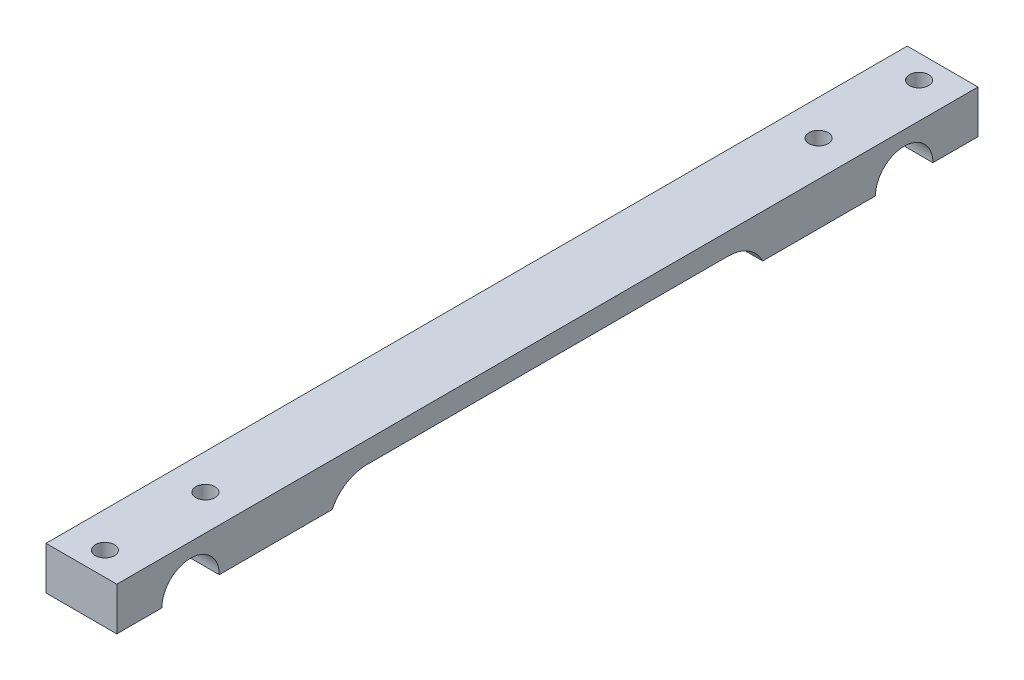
SolidWorks part; units mm, degrees
ref_plane "Front Plane" through (0, 0, 0) normal (0, 0, 1) x (1, 0, 0)
ref_plane "Top Plane" through (0, 0, 0) normal (0, 1, 0) x (1, 0, 0)
ref_plane "Right Plane" through (0, 0, 0) normal (1, 0, 0) x (0, 0, -1)
sketch "Sketch2" plane through (0, 0, 0) normal (1, 0, 0) x (0, 0, -1)
  line L1 (-90, -4.5) -> (90, -4.5)
  line L2 (-90, -4.5) -> (-90, 4.5)
  line L3 (-90, 4.5) -> (90, 4.5)
  line L4 (90, -4.5) -> (90, 4.5)
  line L5 (-90, -4.5) -> (90, 4.5) construction
  line L6 (-90, 4.5) -> (90, -4.5) construction
  point P0 (0, 0)
  dimension "D1" = 9
  dimension "D2" = 180
extrude "Boss-Extrude1" add sketch "Sketch2" along normal blind 14.8
sketch "Sketch3" plane through (14.8, 0, 0) normal (1, 0, 0) x (0, 0, -1)
  line L0 (-90, -4.5) -> (90, -4.5) construction
  line L1 (-74.579, -4.5) -> (74.579, -4.5) construction
  line L7 (90, -4.5) -> (90, 4.5)
  line L8 (90, 4.5) -> (-90, 4.5)
  line L9 (-90, 4.5) -> (-90, -4.5)
  line L10 (-90, -4.5) -> (90, -4.5)
  line L11 (90, -4.5) -> (90, 4.5)
  line L12 (90, 4.5) -> (-90, 4.5)
  line L13 (-90, 4.5) -> (-90, -4.5)
  arc A0 (-68.579, -4.5) -> (-80.579, -4.5) centre (-74.579, -4.5) ccw
  arc A1 (80.579, -4.5) -> (68.579, -4.5) centre (74.579, -4.5) ccw
  point P10 (0, -4.5)
  dimension "D1" = 6
  dimension "D2" = 149.158
  dimension "D4" = 0
extrude "Bar Holes" cut sketch "Sketch3" against normal through all
sketch "Sketch6" plane through (0, 4.5, 0) normal (0, 1, 0) x (1, 0, 0)
  line L0 (7.4, 64.079) -> (7.4, -64.079) construction
  line L1 (14.8, 90) -> (0, 90) construction
  line L2 (14.8, -90) -> (0, -90) construction
  line L3 (0, -68.579) -> (14.8, -68.579) construction
  line L4 (0, -80.579) -> (14.8, -80.579) construction
  line L5 (-32.5661, 0) -> (77.6197, 0) construction
  circle A0 centre (7.4, 64.079) radius 2
  circle A1 centre (7.4, -64.079) radius 2
  circle A2 centre (7.4, -85.079) radius 2
  circle A3 centre (7.4, 85.079) radius 2
  circle A4 centre (7.4, -32.5) radius 3.5 construction
  circle A5 centre (7.4, 32.5) radius 3.5 construction
  point P4 (7.4, 0)
  point P8 (7.4, 90)
  point P17 (7.4, -90)
  dimension "D1" = 4
  dimension "D2" = 4
  dimension "D5" = 4
  dimension "D6" = 4
  dimension "D10" = 7
  dimension "D11" = 7
  dimension "D7" = 32.5
  dimension "D3" = 4.5
  dimension "D4" = 4.5
  dimension "D8" = 4.5
  dimension "D9" = 32.5
extrude "Bolt Holes" cut sketch "Sketch6" against normal through all
sketch "Sketch7" plane through (14.8, 0, 0) normal (1, 0, 0) x (0, 0, -1)
  line L0 (-68.579, -4.5) -> (68.579, -4.5) construction
  line L1 (-45, -4.5) -> (45, -4.5)
  line L2 (-45, -4.5) -> (-45, 0)
  line L3 (-45, 0) -> (45, 0)
  line L4 (45, -4.5) -> (45, 0)
  point P6 (0, 0)
  dimension "D1" = 90
extrude "Cut-Extrude1" cut sketch "Sketch7" against normal through all
fillet "Fillet1" radius 8 2 edges at (7.4, 0, -45) (7.4, 0, 45)
